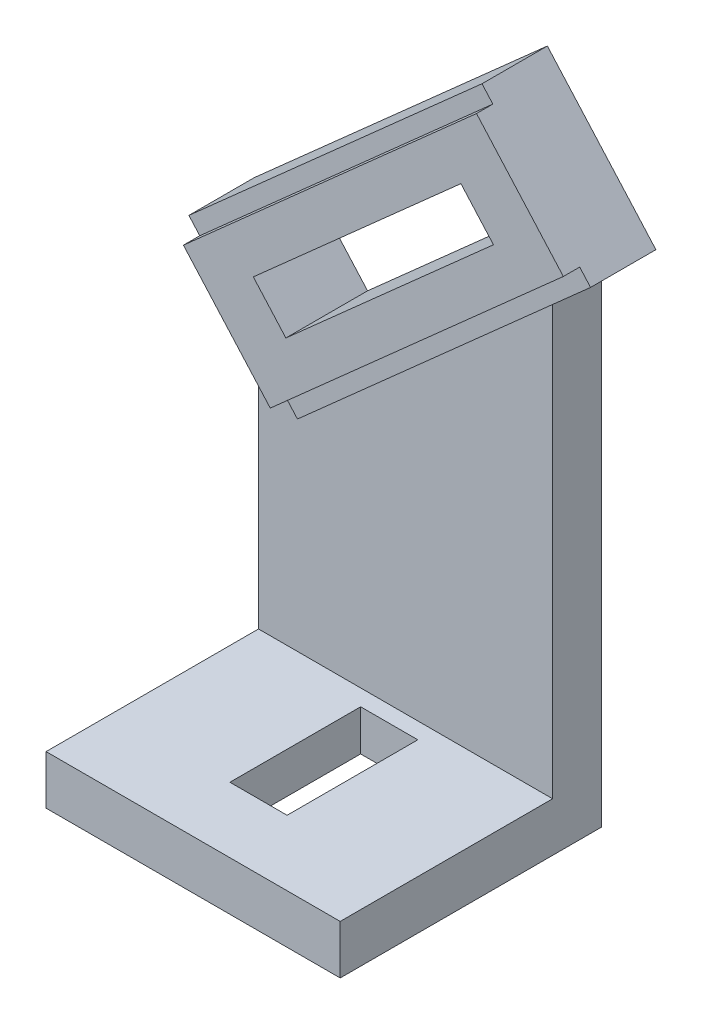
SolidWorks part; units mm, degrees
ref_plane "前视基准面" through (0, 0, 0) normal (0, 0, 1) x (1, 0, 0)
ref_plane "上视基准面" through (0, 0, 0) normal (0, 1, 0) x (1, 0, 0)
ref_plane "右视基准面" through (0, 0, 0) normal (1, 0, 0) x (0, 0, -1)
sketch "草图2" plane through (0, 0, 0) normal (0, 1, 0) x (1, 0, 0)
  line L0 (0, 0) -> (79.8859, 0) construction
  line L1 (0, 0) -> (0, 75.0687) construction
  line L3 (-18, 16) -> (18, 16)
  line L4 (-18, 16) -> (-18, -16)
  line L5 (-18, -16) -> (18, -16)
  line L6 (18, 16) -> (18, -16)
  line L7 (-3.5, 8) -> (3.5, 8)
  line L8 (-3.5, 8) -> (-3.5, -8)
  line L9 (-3.5, -8) -> (3.5, -8)
  line L10 (3.5, 8) -> (3.5, -8)
extrude "拉伸1" add sketch "草图2" along normal blind 6
sketch "草图3" plane through (0, 0, 0) normal (0, -1, 0) x (1, 0, 0)
  line L0 (0, 0) -> (20.296, 0) construction
  line L1 (20.296, 0) -> (0, 0) construction
  line L2 (0, 0) -> (0, 18.0482) construction
  line L4 (-10, 12) -> (10, 12)
  line L5 (-10, 12) -> (-10, -12)
  line L6 (-10, -12) -> (10, -12)
  line L7 (10, 12) -> (10, -12)
extrude "切除-拉伸1" cut sketch "草图3" against normal blind 1
fillet "圆角1" radius 0.5 4 edges at (0, 1, -12) (10, 1, 0) (0, 1, 12) (-10, 1, 0)
sketch "草图4" plane through (0, 0, -16) normal (0, 0, -1) x (-1, 0, 0)
  line L0 (18, 0) -> (-18, 0)
  line L1 (-18, 0) -> (-18, 72)
  line L2 (-18, 72) -> (18, 40)
  line L3 (18, 0) -> (18, 40)
extrude "拉伸2" add sketch "草图4" against normal blind 6
sketch "草图5" plane through (0, 0, -16) normal (0, 0, -1) x (-1, 0, 0)
  line L0 (-18, 72) -> (18, 40) construction
  line L1 (18, 40) -> (38.3862, 21.8789) construction
  line L2 (-24.6436, 64.5259) -> (11.232, 32.6364)
  line L3 (11.232, 32.6364) -> (24.5193, 47.5846)
  line L4 (24.5193, 47.5846) -> (-11.3564, 79.4741)
  line L5 (-11.3564, 79.4741) -> (-24.6436, 64.5259)
  line L6 (0, 0) -> (0, 63.2461) construction
  line L7 (-18, 0) -> (18, 0) construction
extrude "拉伸3" add sketch "草图5" against normal blind 10
sketch "草图6" plane through (0, 0, -6) normal (0, 0, 1) x (1, 0, 0)
  line L0 (-18, 40) -> (18, 72) construction
  line L1 (11.3564, 79.4741) -> (24.6436, 64.5259) construction
  line L2 (-12.5607, 34.1313) -> (23.3149, 66.0207)
  line L3 (-11.232, 32.6364) -> (-24.5193, 47.5846) construction
  line L4 (23.3149, 66.0207) -> (24.6436, 64.5259)
  line L5 (24.6436, 64.5259) -> (-11.232, 32.6364)
  line L6 (-11.232, 32.6364) -> (-12.5607, 34.1313)
  line L7 (12.6851, 77.9793) -> (11.3564, 79.4741)
  line L8 (-24.5193, 47.5846) -> (-23.1906, 46.0898)
  line L9 (11.3564, 79.4741) -> (-24.5193, 47.5846)
  line L10 (-23.1906, 46.0898) -> (12.6851, 77.9793)
extrude "切除-拉伸2" cut sketch "草图6" against normal blind 2
sketch "草图7" plane through (0, 0, -6) normal (0, 0, 1) x (1, 0, 0)
  line L0 (-17.8756, 40.1105) -> (18, 72) construction
  line L1 (-12.5607, 34.1313) -> (-23.1906, 46.0898) construction
  line L2 (12.6851, 77.9793) -> (23.3149, 66.0207) construction
  line L3 (18, 72) -> (28.8002, 81.6002) construction
  line L4 (-14.6369, 47.0033) -> (10.775, 69.5917)
  line L5 (10.775, 69.5917) -> (14.7612, 65.1072)
  line L6 (14.7612, 65.1072) -> (-10.6507, 42.5189)
  line L7 (-10.6507, 42.5189) -> (-14.6369, 47.0033)
  line L8 (0.0622, 56.0553) -> (-12.7155, 70.4301) construction
extrude "切除-拉伸3" cut sketch "草图7" against normal through all
